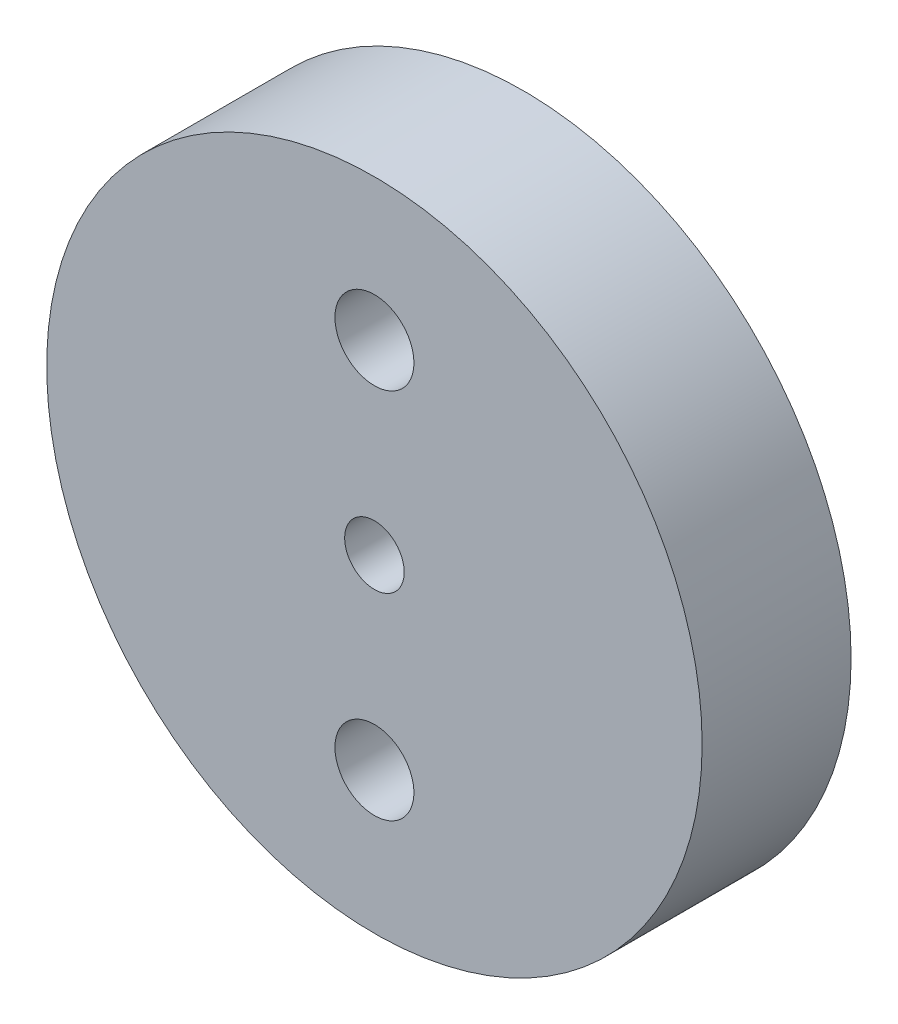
SolidWorks part; units mm, degrees
ref_plane "Front Plane" through (0, 0, 0) normal (0, 0, 1) x (1, 0, 0)
ref_plane "Top Plane" through (0, 0, 0) normal (0, 1, 0) x (1, 0, 0)
ref_plane "Right Plane" through (0, 0, 0) normal (1, 0, 0) x (0, 0, -1)
sketch "Sketch1" plane through (0, 0, 0) normal (0, 0, 1) x (1, 0, 0)
  circle A0 centre (0, 0) radius 22
  dimension "D1" = 44
extrude "Boss-Extrude1" add sketch "Sketch1" along normal blind 10
sketch "Sketch2" plane through (0, 0, 0) normal (0, 0, -1) x (-1, 0, 0)
  circle A0 centre (0, 0) radius 2
extrude "Cut-Extrude1" cut sketch "Sketch2" against normal through all
sketch "Sketch4" plane through (0, 0, 10) normal (0, 0, 1) x (1, 0, 0)
  circle A0 centre (0, 0) radius 12.495
  dimension "D1" = 24.99
hole_wizard "CBORE for M5 SHCS1" positions "Sketch6" profile "Sketch5" counterbore size "M5" standard "Ansi Metric"
sketch "Sketch6" plane through (0, 0, 0) normal (0, 0, -1) x (-1, 0, 0)
  circle A0 centre (0, 0) radius 12.495 construction
  point P0 (0, 12.495)
sketch "Sketch5" plane through (0, 12.495, 0) normal (1, 0, 0) x (0, 1, 0)
  line L0 (0, 0) -> (0, 10)
  line L1 (0, 10) -> (2.65, 10)
  line L3 (2.65, 10) -> (2.65, 6)
  line L4 (2.65, 6) -> (5, 6)
  line L5 (5, 6) -> (5, 0)
  line L7 (5, 0) -> (0, 0)
  line L11 (0, -6.35) -> (0, 107.95) construction
  dimension "Thru Hole Dia." = 5.3
  dimension "Thru Hole Depth" = 10
  dimension "C'Bore Dia." = 10
  dimension "C'Bore Depth" = 6
pattern_circular "CirPattern1" count 2 over 360 about axis through (0, 0, 0) along (0, 0, 1) of "CBORE for M5 SHCS1"
hole_wizard "M3x0.5 Tapped Hole1" positions "Sketch8" profile "Sketch7" tap size "M3x0.5" standard "Ansi Metric"
sketch "Sketch8" plane through (0, 0, 0) normal (0, 0, -1) x (-1, 0, 0)
  point P0 (-7.27, 17.5541)
  dimension "D1" = 19
  dimension "D2" = 7.27
sketch "Sketch7" plane through (7.27, 17.5541, 0) normal (1, 0, 0) x (0, 1, 0)
  line L0 (0, 0) -> (0, 9.2511)
  line L1 (0, 9.2511) -> (1.25, 8.5)
  line L2 (1.25, 8.5) -> (1.25, 0)
  line L5 (1.25, 0) -> (0, 0)
  line L10 (0, 9.2511) -> (-1.25, 8.5) construction
  line L11 (0, -6.35) -> (0, 107.95) construction
  dimension "Tap Drill Dia." = 2.5
  dimension "Tap Drill Depth" = 8.5
  dimension "Drill Angle" = 118
pattern_circular "CirPattern2" count 8 over 360 about axis through (0, 0, 0) along (0, 0, 1) of "M3x0.5 Tapped Hole1"
